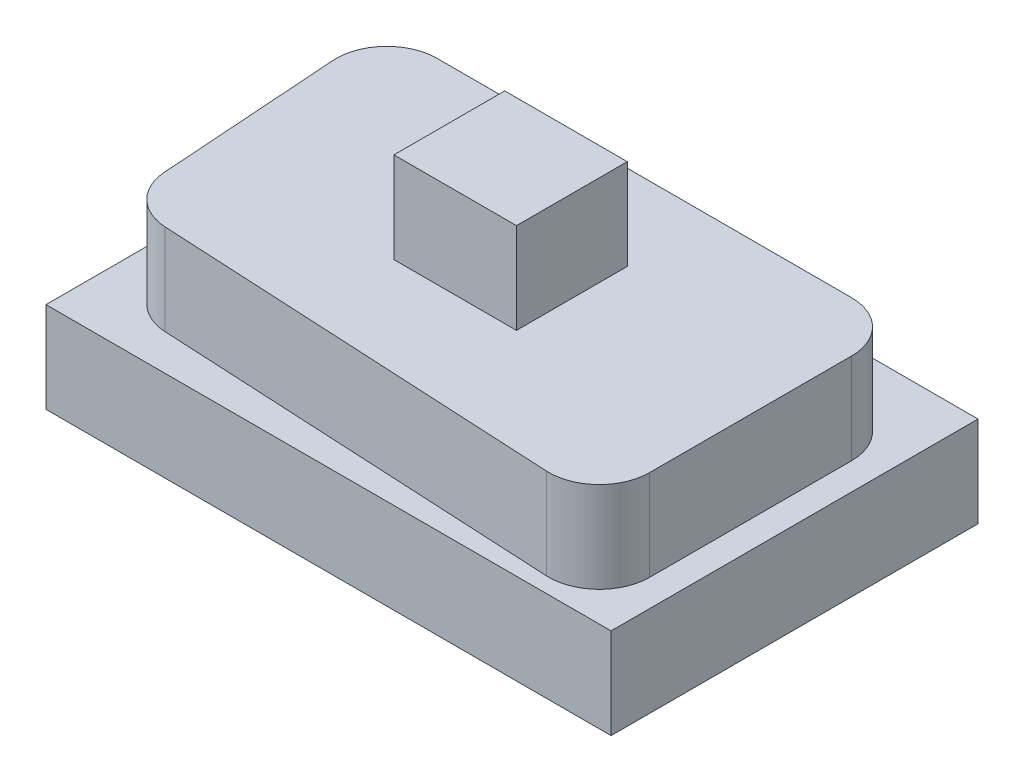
SolidWorks part; units mm, degrees
ref_plane "Front Plane" through (0, 0, 0) normal (0, 0, 1) x (1, 0, 0)
ref_plane "Top Plane" through (0, 0, 0) normal (0, 1, 0) x (1, 0, 0)
ref_plane "Right Plane" through (0, 0, 0) normal (1, 0, 0) x (0, 0, -1)
sketch "Sketch1" plane through (0, 0, 0) normal (0, 1, 0) x (1, 0, 0)
  line L1 (0, 0) -> (56.0446, 0)
  line L2 (0, 0) -> (0, 36.3919)
  line L3 (0, 36.3919) -> (56.0446, 36.3919)
  line L4 (56.0446, 0) -> (56.0446, 36.3919)
extrude "Boss-Extrude1" add sketch "Sketch1" along normal blind 9
sketch "Sketch2" plane through (50.4358, 9, -36.4071) normal (0, 1, 0) x (1, 0, 0)
  line L2 (2.9243, -35.1569) -> (2.9243, -4.8609)
  line L3 (2.9243, -4.8609) -> (-48.5484, -4.8609)
  line L6 (-46.6258, -32.5971) -> (2.9243, -35.1569)
  line L7 (-48.5484, -4.8609) -> (-46.6258, -32.5971)
extrude "Boss-Extrude2" add sketch "Sketch2" along normal blind 9
sketch "Sketch3" plane through (0, 18, 0) normal (0, 1, 0) x (1, 0, 0)
  line L1 (22.3908, 23.1057) -> (34.5461, 23.1057)
  line L2 (22.3908, 23.1057) -> (22.3908, 12.1171)
  line L3 (22.3908, 12.1171) -> (34.5461, 12.1171)
  line L4 (34.5461, 23.1057) -> (34.5461, 12.1171)
extrude "Boss-Extrude3" add sketch "Sketch3" along normal blind 9
fillet "Fillet1" radius 5 4 edges at (1.8874, 13.5, -31.5461) (53.3601, 13.5, -31.5461) (53.3601, 13.5, -1.2502) (3.81, 13.5, -3.81)
